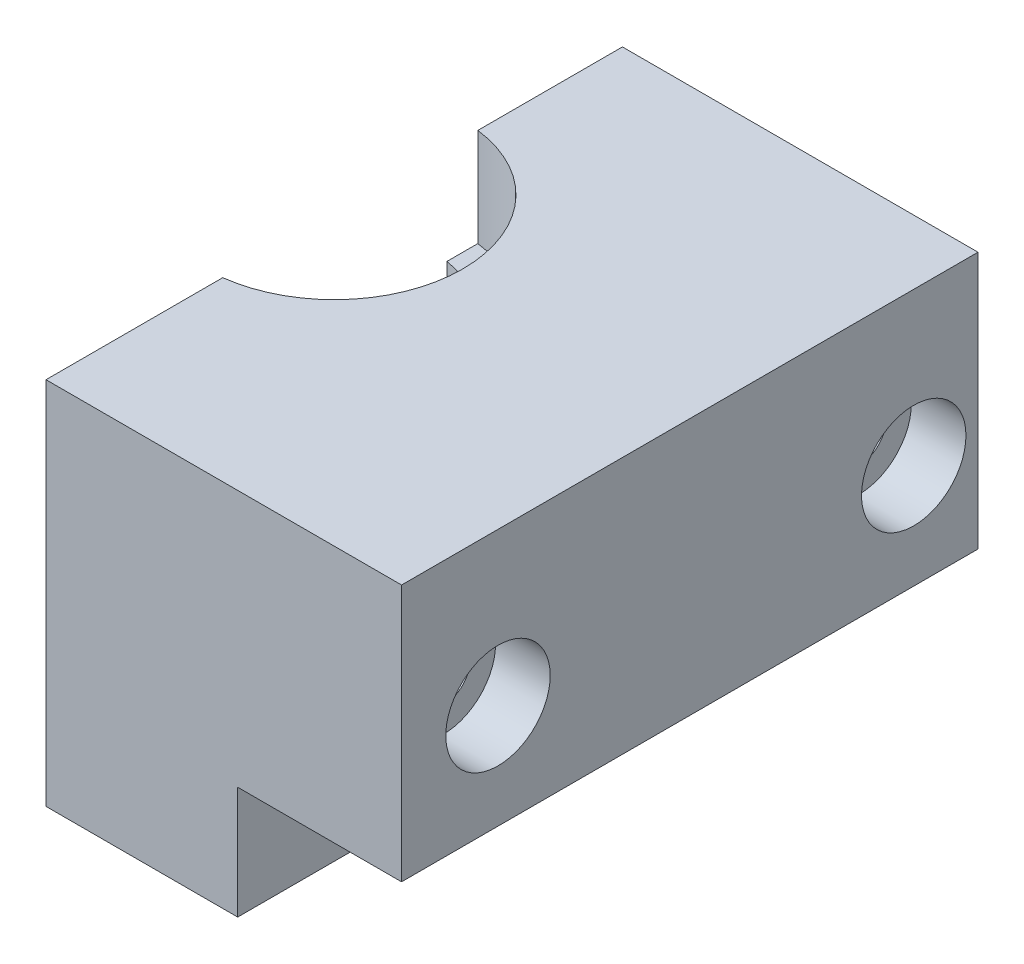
SolidWorks part; units mm, degrees
ref_plane "Aufriss" through (0, 0, 0) normal (0, 0, 1) x (1, 0, 0)
ref_plane "Grundriss" through (0, 0, 0) normal (0, 1, 0) x (1, 0, 0)
ref_plane "Seitenriss" through (0, 0, 0) normal (1, 0, 0) x (0, 0, -1)
sketch "Skizze1" plane through (0, 0, 0) normal (1, 0, 0) x (0, 0, -1)
  line L1 (-17.9375, -11.5) -> (17.9375, -11.5)
  line L2 (-17.9375, -11.5) -> (-17.9375, 11.5)
  line L3 (-17.9375, 11.5) -> (17.9375, 11.5)
  line L4 (17.9375, -11.5) -> (17.9375, 11.5)
  line L5 (-17.9375, -11.5) -> (17.9375, 11.5) construction
  line L6 (-17.9375, 11.5) -> (17.9375, -11.5) construction
  point P0 (0, 0)
  dimension "D1" = 35.875
  dimension "D2" = 23
extrude "Aufsatz-Linear austragen1" add sketch "Skizze1" along normal mid plane 22.13
sketch "Skizze2" plane through (0, 11.5, 0) normal (0, 1, 0) x (1, 0, 0)
  line L0 (-11.065, 17.9375) -> (-11.065, -17.9375) construction
  line L1 (11.065, 17.9375) -> (-11.065, 17.9375) construction
  circle A0 centre (-12.065, 0) radius 8
  dimension "D1" = 16
  dimension "D2" = 1
  dimension "D3" = 17.9375
extrude "Schnitt-Linear austragen1" cut sketch "Skizze2" against normal through all
ref_plane "Ebene1" through (0, -0.3, 0) normal (0, -1, 0) x (-1, 0, 0)
sketch "Skizze5" plane through (0, -0.3, 0) normal (0, -1, 0) x (-1, 0, 0)
  line L0 (11.065, -7.9373) -> (11.065, -6.0175)
  line L1 (11.065, 6.0175) -> (11.065, 7.9373)
  arc A0 (11.065, 7.9373) -> (11.065, -7.9373) centre (12.065, 0) ccw construction
  arc A1 (11.065, 7.9373) -> (11.065, -7.9373) centre (12.065, 0) ccw
  arc A2 (11.065, 6.0175) -> (11.065, -6.0175) centre (12.065, 0) ccw
  dimension "D1" = 12.2
extrude "Aufsatz-Linear austragen2" add sketch "Skizze5" against normal blind 5.7
ref_plane "Ebene2" through (0.865, 0, 0) normal (1, 0, 0) x (0, 0, -1)
sketch "Skizze12" plane through (0.865, 0, 0) normal (1, 0, 0) x (0, 0, -1)
  line L0 (17.9375, -11.5) -> (17.9375, 11.5) construction
  line L1 (-17.9375, -11.5) -> (17.9375, -11.5)
  line L2 (-17.9375, -11.5) -> (-17.9375, -4.5)
  line L3 (-17.9375, -4.5) -> (17.9375, -4.5)
  line L4 (17.9375, -11.5) -> (17.9375, -4.5)
  dimension "D1" = 7
extrude "Schnitt-Linear austragen5" cut sketch "Skizze12" along normal through all
hole_wizard "Ø4.0 (4) Durchmesser Bohrung1" positions "Skizze13" profile "Skizze14" hole size "Ø4.0" standard "DIN"
sketch "Skizze13" plane through (0.865, 0, 0) normal (1, 0, 0) x (0, 0, -1)
  line L0 (17.9375, -4.5) -> (-17.9375, -4.5) construction
  point P0 (-12, -7.5)
  point P2 (12, -7.5)
  dimension "D1" = 3
  dimension "D2" = 12
  dimension "D3" = 12
sketch "Skizze14" plane through (0.865, -7.5, 12) normal (0, 1, 0) x (0, 0, -1)
  line L0 (0, 0) -> (0, 7)
  line L1 (0, 7) -> (2, 7)
  line L2 (2, 7) -> (2, 0)
  line L5 (2, 0) -> (0, 0)
  line L10 (0, 7) -> (-2, 7) construction
  line L11 (0, -6.35) -> (0, 107.95) construction
  dimension "Bohrerdurchmesser" = 4
  dimension "Bohrungstiefe" = 7
  dimension "Spitzenwinkel" = 180
ref_plane "Ebene3" through (0.865, -11.5, 17.9375) normal (0, 0, -1) x (-1, 0, 0)
sketch "Skizze17" plane through (11.065, 0, 0) normal (1, 0, 0) x (0, 0, -1)
  line L0 (-17.9375, -11.5) -> (17.9375, -11.5) construction
  line L1 (-17.9375, 11.5) -> (-16.9375, 11.5)
  line L2 (-17.9375, 11.5) -> (-17.9375, -11.5)
  line L3 (-17.9375, -11.5) -> (-16.9375, -11.5)
  line L4 (-16.9375, 11.5) -> (-16.9375, -11.5)
  line L5 (-17.9375, -11.5) -> (17.9375, -11.5) construction
  line L6 (17.9375, 11.5) -> (16.9375, 11.5)
  line L7 (17.9375, 11.5) -> (17.9375, -11.5)
  line L8 (17.9375, -11.5) -> (16.9375, -11.5)
  line L9 (16.9375, 11.5) -> (16.9375, -11.5)
  dimension "D1" = 1
extrude "Schnitt-Linear austragen7" cut sketch "Skizze17" against normal through all
hole_wizard "Stirnsenkung für M3 Zylinderschraube mit Innensechskant1" positions "Skizze3" profile "Skizze4" counterbore size "M3" standard "DIN"
sketch "Skizze3" plane through (11.065, 0, 0) normal (1, 0, 0) x (0, 0, -1)
  line L2 (-16.9375, -4.5) -> (-16.9375, 11.5) construction
  line L3 (16.9375, 11.5) -> (16.9375, -4.5) construction
  line L4 (16.9375, 11.5) -> (-16.9375, 11.5) construction
  point P0 (-12.9375, 2)
  point P2 (12.9375, 2)
  dimension "D1" = 4
  dimension "D2" = 4
  dimension "D3" = 9.5
sketch "Skizze4" plane through (11.065, 2, 12.9375) normal (0, 1, 0) x (0, 0, -1)
  line L0 (0, 0) -> (0, 22.13)
  line L1 (0, 22.13) -> (1.7, 22.13)
  line L3 (1.7, 22.13) -> (1.7, 3.4)
  line L4 (1.7, 3.4) -> (3.25, 3.4)
  line L5 (3.25, 3.4) -> (3.25, 0)
  line L7 (3.25, 0) -> (0, 0)
  line L11 (0, -6.35) -> (0, 107.95) construction
  dimension "Bohrerdurchmesser" = 3.4
  dimension "Bohrungstiefe" = 22.13
  dimension "Senkdurchmesser2" = 6.5
  dimension "Senktiefe2" = 3.4
sketch "Skizze16" plane through (0.865, 0, 0) normal (1, 0, 0) x (0, 0, -1)
  circle A0 centre (0, -19.5) radius 12.5
  circle A2 centre (-12, -7.5) radius 2 construction
  dimension "D1" = 12
  dimension "D2" = 25
extrude "Schnitt-Linear austragen6" cut sketch "Skizze16" against normal through all
sketch "Skizze19" plane through (0, -11.5, 0) normal (0, -1, 0) x (1, 0, 0)
  circle A0 centre (-12.065, 0) radius 11.5
  dimension "D1" = 23
extrude "Schnitt-Linear austragen8" cut sketch "Skizze19" against normal blind 4
sketch "Skizze20" plane through (0, 0, 16.9375) normal (0, 0, 1) x (1, 0, 0)
  line L6 (0.865, -4.5) -> (11.065, -4.5)
  line L7 (11.065, -4.5) -> (11.065, 11.5)
  line L8 (11.065, 11.5) -> (-11.065, 11.5)
  line L9 (-11.065, 11.5) -> (-11.065, -11.5)
  line L10 (-11.065, -11.5) -> (0.865, -11.5)
  line L11 (0.865, -11.5) -> (0.865, -4.5)
  line L12 (0.865, -4.5) -> (11.065, -4.5)
  line L13 (11.065, -4.5) -> (11.065, 11.5)
  line L14 (11.065, 11.5) -> (-11.065, 11.5)
  line L15 (-11.065, 11.5) -> (-11.065, -11.5)
  line L16 (-11.065, -11.5) -> (0.865, -11.5)
  line L17 (0.865, -11.5) -> (0.865, -4.5)
  dimension "D1" = 0
extrude "Aufsatz-Linear austragen3" add sketch "Skizze20" along normal blind 2
